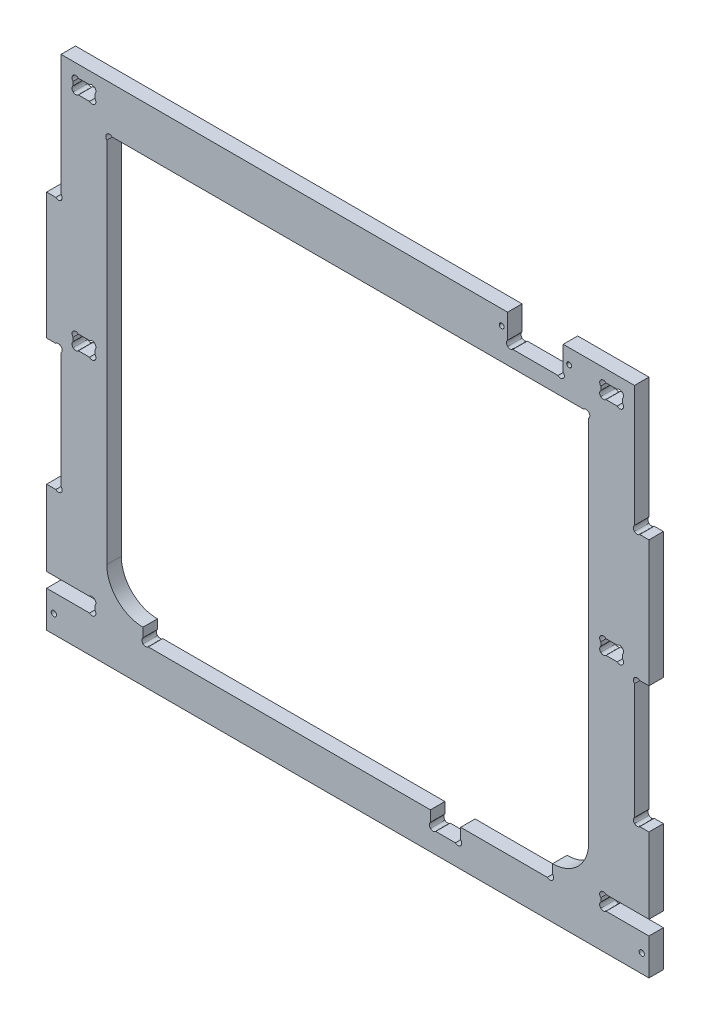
SolidWorks part; units mm, degrees
ref_plane "Plan de face" through (0, 0, 0) normal (0, 0, 1) x (1, 0, 0)
ref_plane "Plan de dessus" through (0, 0, 0) normal (0, 1, 0) x (1, 0, 0)
ref_plane "Plan de droite" through (0, 0, 0) normal (1, 0, 0) x (0, 0, -1)
body saved out of another part "Stock-Pièce3-1"
sketch "Esquisse1" plane through (0, 0, 6) normal (0, 0, 1) x (1, 0, 0)
  line L0 (2279.6745, 39.2746) -> (2284.2905, 39.2746) construction
  line L1 (2281.9825, 39.2746) -> (2301.7412, 39.2746)
  line L2 (2281.9825, 39.2746) -> (2281.9825, 33.2746)
  line L3 (2281.9825, 33.2746) -> (2301.7412, 33.2746)
  line L4 (2301.7412, 39.2746) -> (2301.7412, 33.2746)
  line L5 (2284.2905, 33.2746) -> (2279.6745, 33.2746) construction
  line L6 (2065.2882, 39.2746) -> (2060.6722, 39.2746) construction
  line L7 (2062.9802, 39.2746) -> (2044.4603, 39.2746)
  line L8 (2062.9802, 39.2746) -> (2062.9802, 33.2746)
  line L9 (2062.9802, 33.2746) -> (2044.4603, 33.2746)
  line L10 (2044.4603, 39.2746) -> (2044.4603, 33.2746)
  line L11 (2060.6722, 33.2746) -> (2065.2882, 33.2746) construction
  point P14 (2062.9802, 33.2746)
  point P17 (2044.4603, 33.2746)
extrude "Enlèv. mat.-Extru.1" cut sketch "Esquisse1" against normal through all
sketch "Esquisse2" plane through (0, 0, 6) normal (0, 0, 1) x (1, 0, 0)
  line L0 (2058.4802, 39.2746) -> (2047.4802, 39.2746) construction
  line L1 (2054.8235, 39.2746) -> (2063.2742, 39.2746)
  line L2 (2054.8235, 39.2746) -> (2054.8235, 41.5371)
  line L3 (2054.8235, 41.5371) -> (2063.2742, 41.5371)
  line L4 (2063.2742, 39.2746) -> (2063.2742, 41.5371)
  line L5 (2060.6722, 33.2746) -> (2065.2882, 33.2746) construction
  line L6 (2061.9308, 33.2746) -> (2055.5169, 33.2746)
  line L7 (2061.9308, 33.2746) -> (2061.9308, 32.0889)
  line L8 (2061.9308, 32.0889) -> (2055.5169, 32.0889)
  line L9 (2055.5169, 33.2746) -> (2055.5169, 32.0889)
  line L10 (2279.6745, 39.2746) -> (2284.2905, 39.2746) construction
  line L11 (2282.691, 39.2746) -> (2288.3026, 39.2746)
  line L12 (2282.691, 39.2746) -> (2282.691, 41.5371)
  line L13 (2282.691, 41.5371) -> (2288.3026, 41.5371)
  line L14 (2288.3026, 39.2746) -> (2288.3026, 41.5371)
  line L15 (2284.2905, 33.2746) -> (2279.6745, 33.2746) construction
  line L16 (2282.691, 33.2746) -> (2288.9366, 33.2746)
  line L17 (2282.691, 33.2746) -> (2282.691, 30.6972)
  line L18 (2282.691, 30.6972) -> (2288.9366, 30.6972)
  line L19 (2288.9366, 33.2746) -> (2288.9366, 30.6972)
  point P24 (2288.9366, 30.6972)
extrude "Boss.-Extru.1" add sketch "Esquisse2" against normal up to surface (6 mm away)
sketch "Esquisse3" plane through (0, 0, 6) normal (0, 0, 1) x (1, 0, 0)
  line L0 (2047.4802, 33.2746) -> (2047.4802, 18.1746) construction
  line L1 (2047.4802, 18.1746) -> (2297.4825, 18.1746) construction
  line L2 (2172.4814, 18.1746) -> (2172.4814, -6.2273) construction
  circle A0 centre (2050.4802, 25.6746) radius 1.1
  circle A1 centre (2294.4825, 25.6746) radius 1.1
  dimension "D1" = 2.2
  dimension "D2" = 3
  dimension "D3" = 7.5
extrude "Enlèv. mat.-Extru.2" cut sketch "Esquisse3" against normal through all
